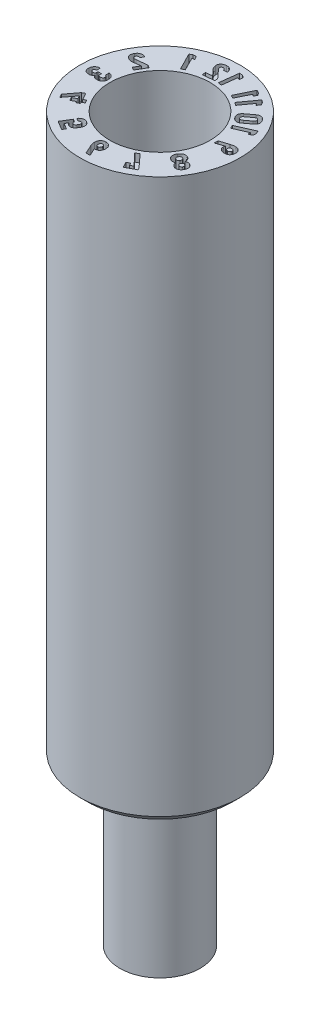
SolidWorks part; units mm, degrees
other "<M2L6-SetScrew>-<Chamfer1>" parameters "D10"=0.19
ref_plane "Front Plane" through (0, 0, 0) normal (0, 0, 1) x (1, 0, 0)
ref_plane "Top Plane" through (0, 0, 0) normal (0, 1, 0) x (1, 0, 0)
ref_plane "Right Plane" through (0, 0, 0) normal (1, 0, 0) x (0, 0, -1)
sketch "Sketch1" plane through (0, 0, 0) normal (0, 0, 1) x (1, 0, 0)
  line L0 (0, 0) -> (0, 20) construction
  line L1 (0, -55) -> (0, 55) construction
  line L2 (1, -14) -> (1.81, -14)
  line L4 (2, -13.81) -> (2, 0)
  line L5 (2, 0) -> (1.25, 0)
  line L6 (1.25, 0) -> (1.25, -2.3)
  line L7 (1.25, -2.3) -> (0.7, -2.3)
  line L8 (0.7, -2.3) -> (0.7, -10.5)
  line L9 (0.7, -10.5) -> (1, -10.5)
  line L10 (1, -10.5) -> (1, -14)
  line L11 (1.81, -14) -> (2, -13.81)
  point P6 (2, -14)
  dimension "D1" = 2.3
  dimension "D2" = 3.5
  dimension "D3" = 1.4
  dimension "D4" = 2.5
  dimension "D5" = 4
  dimension "D6" = 2
  dimension "D7" = 14
revolve "Revolve1" add sketch "Sketch1" angle 360 about L0
sketch "Sketch2" plane through (0, 0, 0) normal (0, 1, 0) x (1, 0, 0)
  line L0 (0, 0) -> (0, 2.1482) construction
  line L1 (0, 0) -> (1.0741, 1.8604) construction
  line L2 (0, 0) -> (1.8604, 1.0741) construction
  line L3 (0, 0) -> (2.1482, 0) construction
  line L4 (0, 0) -> (1.8604, -1.0741) construction
  line L5 (0, 0) -> (1.0741, -1.8604) construction
  line L6 (0, 0) -> (0, -2.1482) construction
  line L7 (0, 0) -> (-1.0741, -1.8604) construction
  line L8 (0, 0) -> (-1.8604, -1.0741) construction
  line L9 (0, 0) -> (-2.1482, 0) construction
  line L10 (0, 0) -> (-1.8604, 1.0741) construction
  line L11 (0, 0) -> (-1.0741, 1.8604) construction
  line L12 (1.2057, 0.5996) -> (1.2425, 0.5167)
  line L13 (1.2425, 0.5167) -> (1.5851, 0.6685)
  line L14 (1.5851, 0.6685) -> (1.5885, 0.606)
  line L15 (1.5885, 0.606) -> (1.6766, 0.645)
  line L16 (1.6766, 0.645) -> (1.6771, 0.7238)
  line L17 (1.6771, 0.7238) -> (1.6457, 0.7946)
  line L18 (1.6457, 0.7946) -> (1.2057, 0.5996)
  line L19 (1.2646, 0.7609) -> (1.4402, 0.8917)
  line L20 (1.268, 1.1229) -> (1.0924, 0.9921)
  line L21 (1.1652, 0.9332) -> (1.3037, 1.0363)
  line L22 (1.3674, 0.9507) -> (1.2289, 0.8476)
  line L23 (0.7385, 1.1261) -> (0.8123, 1.0729)
  line L24 (0.8123, 1.0729) -> (1.0322, 1.3772)
  line L25 (1.0322, 1.3772) -> (1.0667, 1.3249)
  line L26 (1.0667, 1.3249) -> (1.1232, 1.4031)
  line L27 (1.1232, 1.4031) -> (1.084, 1.4716)
  line L28 (1.084, 1.4716) -> (1.021, 1.517)
  line L29 (1.021, 1.517) -> (0.7385, 1.1261)
  line L30 (0.5412, 1.233) -> (0.6225, 1.193)
  line L31 (0.6225, 1.193) -> (0.7879, 1.5289)
  line L32 (0.7879, 1.5289) -> (0.8306, 1.4831)
  line L33 (0.8306, 1.4831) -> (0.8731, 1.5695)
  line L34 (0.8731, 1.5695) -> (0.8231, 1.6303)
  line L35 (0.8231, 1.6303) -> (0.7536, 1.6644)
  line L36 (0.7536, 1.6644) -> (0.5412, 1.233)
  line L37 (0.1081, 1.3422) -> (0.1977, 1.331)
  line L38 (0.1977, 1.331) -> (0.2439, 1.7013)
  line L39 (0.2439, 1.7013) -> (0.2991, 1.6722)
  line L40 (0.2991, 1.6722) -> (0.311, 1.7673)
  line L41 (0.311, 1.7673) -> (0.2439, 1.8082)
  line L42 (0.2439, 1.8082) -> (0.1674, 1.8178)
  line L43 (0.1674, 1.8178) -> (0.1081, 1.3422)
  line L44 (0.0113, 1.4273) -> (-0.1729, 1.6291)
  line L45 (-0.2015, 1.6853) -> (-0.2015, 1.686)
  line L46 (-0.0988, 1.6793) -> (-0.0988, 1.6789)
  line L47 (-0.0988, 1.6789) -> (-0.006, 1.6872)
  line L48 (-0.006, 1.6872) -> (-0.0061, 1.6876)
  line L49 (-0.2949, 1.6803) -> (-0.2949, 1.6799)
  line L50 (-0.2406, 1.5608) -> (-0.1091, 1.4221)
  line L51 (-0.1091, 1.4221) -> (-0.2731, 1.4073)
  line L52 (-0.2731, 1.4073) -> (-0.2652, 1.3202)
  line L53 (-0.2652, 1.3202) -> (0.0186, 1.3457)
  line L54 (0.0186, 1.3457) -> (0.0113, 1.4273)
  line L55 (-0.6617, 1.1726) -> (-0.5814, 1.2135)
  line L56 (-0.5814, 1.2135) -> (-0.7503, 1.5455)
  line L57 (-0.7503, 1.5455) -> (-0.6884, 1.5523)
  line L58 (-0.6884, 1.5523) -> (-0.7319, 1.6377)
  line L59 (-0.7319, 1.6377) -> (-0.8101, 1.634)
  line L60 (-0.8101, 1.634) -> (-0.8787, 1.5991)
  line L61 (-0.8787, 1.5991) -> (-0.6617, 1.1726)
  line L62 (-1.1474, 0.849) -> (-1.4187, 0.8188)
  line L63 (-1.4812, 0.8289) -> (-1.4818, 0.8292)
  line L64 (-1.4158, 0.9083) -> (-1.4155, 0.9081)
  line L65 (-1.4155, 0.9081) -> (-1.3677, 0.9879)
  line L66 (-1.3677, 0.9879) -> (-1.368, 0.9881)
  line L67 (-1.5321, 0.7504) -> (-1.5318, 0.7502)
  line L68 (-1.4034, 0.724) -> (-1.2139, 0.7486)
  line L69 (-1.2139, 0.7486) -> (-1.2986, 0.6075)
  line L70 (-1.2986, 0.6075) -> (-1.2236, 0.5625)
  line L71 (-1.2236, 0.5625) -> (-1.0771, 0.8069)
  line L72 (-1.0771, 0.8069) -> (-1.1474, 0.849)
  line L73 (-1.4629, 0.1949) -> (-1.4655, 0.1015)
  line L74 (-1.4765, -0.0026) -> (-1.4877, -0.0023)
  line L75 (-1.5437, 0.0431) -> (-1.5426, 0.0837)
  line L76 (-1.5426, 0.0837) -> (-1.6297, 0.0861)
  line L77 (-1.6297, 0.0861) -> (-1.6309, 0.0456)
  line L78 (-1.6813, 0.0109) -> (-1.6896, 0.0111)
  line L79 (-1.6803, 0.0997) -> (-1.6777, 0.1928)
  line L80 (-1.7015, -0.0857) -> (-1.687, -0.0861)
  line L81 (-1.4835, -0.0995) -> (-1.469, -0.0999)
  line L82 (-1.3866, -0.5754) -> (-1.6002, -0.8592)
  line L83 (-1.6002, -0.8592) -> (-1.5515, -0.9492)
  line L84 (-1.5515, -0.9492) -> (-1.3395, -0.6708)
  line L85 (-1.3395, -0.6708) -> (-1.2972, -0.7489)
  line L86 (-1.2369, -0.8604) -> (-1.1602, -0.8189)
  line L87 (-1.1602, -0.8189) -> (-1.1781, -0.7858)
  line L88 (-1.3134, -0.5358) -> (-1.3866, -0.5754)
  line L89 (-1.4047, -0.8055) -> (-1.3616, -0.8851)
  line L90 (-1.3616, -0.8851) -> (-1.2548, -0.8273)
  line L91 (-1.1131, -0.7506) -> (-1.1562, -0.671)
  line L92 (-1.1562, -0.671) -> (-1.2212, -0.7062)
  line L93 (-0.8873, -1.1875) -> (-0.8874, -1.1878)
  line L94 (-0.8874, -1.1878) -> (-0.8103, -1.2346)
  line L95 (-0.8103, -1.2346) -> (-0.8102, -1.2343)
  line L96 (-0.7258, -1.2898) -> (-0.7466, -1.3242)
  line L97 (-0.84, -1.2923) -> (-0.9121, -1.2486)
  line L98 (-0.9121, -1.2486) -> (-1.0549, -1.4838)
  line L99 (-1.0549, -1.4838) -> (-0.8351, -1.6172)
  line L100 (-0.8351, -1.6172) -> (-0.79, -1.5429)
  line L101 (-0.79, -1.5429) -> (-0.9326, -1.4564)
  line L102 (-0.9326, -1.4564) -> (-0.8888, -1.384)
  line L103 (-0.6695, -1.371) -> (-0.6487, -1.3366)
  line L104 (-1.2212, -0.7062) -> (-1.3134, -0.5358)
  line L105 (-1.2548, -0.8273) -> (-1.2369, -0.8604)
  line L106 (-1.1781, -0.7858) -> (-1.1131, -0.7506)
  line L107 (-1.2979, -0.7477) -> (-1.4047, -0.8055)
  line L108 (-0.1507, -1.4779) -> (-0.1507, -1.4782)
  line L109 (-0.1188, -1.6117) -> (-0.0234, -1.8193)
  line L110 (-0.0234, -1.8193) -> (0.0789, -1.8203)
  line L111 (0.0789, -1.8203) -> (-0.0139, -1.6229)
  line L113 (0.1303, -1.4827) -> (0.1303, -1.4825)
  line L114 (0.0398, -1.476) -> (0.0398, -1.4763)
  line L115 (-0.0603, -1.4749) -> (-0.0603, -1.4745)
  line L116 (0.9592, -1.4815) -> (0.667, -1.1636)
  line L117 (0.667, -1.1636) -> (0.5809, -1.2098)
  line L118 (0.5809, -1.2098) -> (0.8577, -1.5054)
  line L119 (0.8577, -1.5054) -> (0.7852, -1.5443)
  line L120 (0.7852, -1.5443) -> (0.7511, -1.4808)
  line L121 (0.7511, -1.4808) -> (0.6717, -1.5234)
  line L122 (0.6717, -1.5234) -> (0.7468, -1.6634)
  line L123 (0.7468, -1.6634) -> (0.9875, -1.5341)
  line L124 (0.9875, -1.5341) -> (0.9592, -1.4815)
  line L125 (1.1664, -0.9013) -> (1.173, -0.9055)
  line L126 (1.3562, -1.0104) -> (1.3668, -1.0171)
  line L127 (1.5203, -0.7762) -> (1.5097, -0.7695)
  line L128 (1.3372, -0.6478) -> (1.3306, -0.6436)
  line L129 (1.293, -0.7273) -> (1.2968, -0.7298)
  line L130 (1.23, -0.8341) -> (1.2258, -0.8314)
  line L131 (1.4578, -0.8441) -> (1.4616, -0.8466)
  line L132 (1.4055, -0.9341) -> (1.4014, -0.9314)
  line L134 (1.6864, -0.1011) -> (1.6867, -0.1012)
  line L135 (1.7089, 0.1799) -> (1.7086, 0.1799)
  line L136 (1.5753, 0.1572) -> (1.3623, 0.0888)
  line L137 (1.3623, 0.0888) -> (1.3542, -0.0069)
  line L138 (1.3542, -0.0069) -> (1.5632, 0.0643)
  line L139 (1.7051, 0.0891) -> (1.7054, 0.089)
  line L140 (1.6967, -0.011) -> (1.6963, -0.0109)
  circle A0 centre (0, 0) radius 1.35 construction
  spline S0 degree 3 poles (1.0687, 0.7947) (1.0754, 0.7858) (1.0858, 0.7734) (1.1012, 0.7591) (1.1128, 0.7503) (1.1246, 0.7429) (1.1368, 0.7371) (1.1492, 0.7329) (1.1619, 0.73) (1.1747, 0.7289) (1.1876, 0.729) (1.2004, 0.7307) (1.2133, 0.7339) (1.2263, 0.7384) (1.2438, 0.7468) (1.2565, 0.7547) (1.2646, 0.7609) knots 0 0 0 0 0.147117 0.214402 0.278561 0.339909 0.398973 0.456512 0.51374 0.57063 0.626826 0.684108 0.742238 0.802596 0.865353 1 1 1 1
  spline S1 degree 3 poles (1.4402, 0.8917) (1.4484, 0.8979) (1.4599, 0.9075) (1.4729, 0.9222) (1.4811, 0.9333) (1.4877, 0.9448) (1.4929, 0.9567) (1.4969, 0.9689) (1.4992, 0.9816) (1.5001, 0.9945) (1.4995, 1.0076) (1.4974, 1.0209) (1.4937, 1.0343) (1.4886, 1.0479) (1.4792, 1.0666) (1.4705, 1.0802) (1.4638, 1.089) knots 0 0 0 0 0.136047 0.198883 0.259431 0.317603 0.374632 0.431247 0.487747 0.544883 0.602554 0.661504 0.722654 0.78644 0.853707 1 1 1 1
  spline S2 degree 3 poles (1.4638, 1.089) (1.4572, 1.0979) (1.4468, 1.1104) (1.4313, 1.1246) (1.4198, 1.1335) (1.4081, 1.141) (1.396, 1.1468) (1.3837, 1.1511) (1.3711, 1.154) (1.3583, 1.1553) (1.3455, 1.1551) (1.3326, 1.1536) (1.3197, 1.1502) (1.3068, 1.1456) (1.289, 1.1373) (1.2762, 1.1292) (1.268, 1.1229) knots 0 0 0 0 0.146929 0.214129 0.277956 0.33934 0.397903 0.455386 0.51208 0.56839 0.624514 0.681549 0.739824 0.80036 0.863359 1 1 1 1
  spline S3 degree 3 poles (1.0924, 0.9921) (1.0842, 0.9859) (1.0726, 0.9762) (1.0597, 0.9615) (1.0514, 0.9505) (1.0449, 0.9389) (1.0394, 0.9271) (1.0357, 0.9148) (1.0332, 0.9021) (1.0323, 0.8892) (1.0329, 0.8761) (1.0351, 0.8629) (1.0388, 0.8495) (1.044, 0.8359) (1.0534, 0.8172) (1.0621, 0.8035) (1.0687, 0.7947) knots 0 0 0 0 0.136019 0.198842 0.259378 0.317958 0.375029 0.431628 0.488072 0.545196 0.602448 0.661574 0.722711 0.786484 0.853737 1 1 1 1
  spline S4 degree 3 poles (1.1389, 0.847) (1.1362, 0.8504) (1.1331, 0.8559) (1.1297, 0.8633) (1.1283, 0.8689) (1.1274, 0.8744) (1.1275, 0.8798) (1.1282, 0.8853) (1.1301, 0.8927) (1.1346, 0.9019) (1.1456, 0.9172) (1.1569, 0.9269) (1.1652, 0.9332) knots 0 0 0 0 0.125725 0.183945 0.238714 0.292444 0.345219 0.398346 0.452716 0.568249 0.696065 1 1 1 1
  spline S5 degree 3 poles (1.3037, 1.0363) (1.312, 1.0426) (1.3246, 1.0504) (1.3423, 1.0567) (1.3542, 1.0584) (1.3656, 1.0575) (1.3802, 1.0519) (1.3889, 1.0433) (1.3937, 1.0368) knots 0 0 0 0 0.305311 0.43194 0.547296 0.654391 0.761589 1 1 1 1
  spline S6 degree 3 poles (1.3937, 1.0368) (1.3963, 1.0334) (1.3995, 1.0279) (1.4028, 1.0204) (1.4044, 1.0149) (1.4051, 1.0094) (1.4051, 1.0039) (1.4044, 0.9985) (1.4024, 0.9911) (1.398, 0.9819) (1.3872, 0.9666) (1.3756, 0.957) (1.3674, 0.9507) knots 0 0 0 0 0.125814 0.184074 0.239386 0.292755 0.345568 0.398732 0.45314 0.567811 0.695414 1 1 1 1
  spline S7 degree 3 poles (1.2289, 0.8476) (1.2206, 0.8414) (1.208, 0.8333) (1.1903, 0.8272) (1.1784, 0.8253) (1.167, 0.8263) (1.1524, 0.8319) (1.1437, 0.8405) (1.1389, 0.847) knots 0 0 0 0 0.304488 0.431839 0.547543 0.654592 0.760791 1 1 1 1
  spline S8 degree 3 poles (-0.1729, 1.6291) (-0.1808, 1.6374) (-0.1891, 1.6492) (-0.1962, 1.6644) (-0.1996, 1.6737) (-0.201, 1.6807) (-0.2015, 1.6853) knots 0 0 0 0 0.53955 0.66565 0.783202 1 1 1 1
  spline S9 degree 3 poles (-0.2015, 1.686) (-0.2021, 1.6918) (-0.2016, 1.7006) (-0.197, 1.711) (-0.1919, 1.7174) (-0.1852, 1.7227) (-0.1739, 1.7286) (-0.1639, 1.7302) (-0.1571, 1.7309) knots 0 0 0 0 0.245619 0.358314 0.46938 0.58591 0.710099 1 1 1 1
  spline S10 degree 3 poles (-0.1571, 1.7309) (-0.1501, 1.7317) (-0.1398, 1.7307) (-0.1272, 1.7257) (-0.1191, 1.7197) (-0.1121, 1.712) (-0.104, 1.6989) (-0.1005, 1.6874) (-0.0988, 1.6793) knots 0 0 0 0 0.240793 0.353898 0.468452 0.587551 0.713116 1 1 1 1
  spline S11 degree 3 poles (-0.0061, 1.6876) (-0.0082, 1.7016) (-0.0133, 1.7218) (-0.0242, 1.7467) (-0.0342, 1.7629) (-0.0457, 1.7774) (-0.0588, 1.7897) (-0.0734, 1.8) (-0.0893, 1.8082) (-0.1066, 1.8141) (-0.1316, 1.8193) (-0.1511, 1.8194) (-0.1643, 1.8182) knots 0 0 0 0 0.185577 0.271291 0.354122 0.434342 0.512451 0.589112 0.667053 0.74636 0.827362 1 1 1 1
  spline S12 degree 3 poles (-0.1643, 1.8182) (-0.1782, 1.8168) (-0.1984, 1.8136) (-0.2233, 1.8049) (-0.2396, 1.797) (-0.2541, 1.7876) (-0.2663, 1.7764) (-0.2767, 1.7638) (-0.2848, 1.7496) (-0.2908, 1.734) (-0.2959, 1.7109) (-0.296, 1.6926) (-0.2949, 1.6803) knots 0 0 0 0 0.194757 0.282954 0.366363 0.445797 0.521795 0.596412 0.671721 0.748251 0.827508 1 1 1 1
  spline S13 degree 3 poles (-0.2949, 1.6799) (-0.2939, 1.669) (-0.291, 1.6527) (-0.2842, 1.6316) (-0.2779, 1.6159) (-0.2702, 1.6009) (-0.2585, 1.5819) (-0.2482, 1.5687) (-0.2406, 1.5608) knots 0 0 0 0 0.246099 0.371171 0.498698 0.625929 0.751174 1 1 1 1
  spline S14 degree 3 poles (-1.4187, 0.8188) (-1.4302, 0.8175) (-1.4447, 0.8176) (-1.4612, 0.8209) (-1.4707, 0.8235) (-1.4771, 0.8267) (-1.4812, 0.8289) knots 0 0 0 0 0.541742 0.666101 0.784532 1 1 1 1
  spline S15 degree 3 poles (-1.4818, 0.8292) (-1.4867, 0.8323) (-1.4936, 0.8378) (-1.4992, 0.8477) (-1.5014, 0.8556) (-1.5018, 0.864) (-1.4996, 0.8766) (-1.4954, 0.8857) (-1.4917, 0.8916) knots 0 0 0 0 0.245993 0.357942 0.469858 0.585868 0.709526 1 1 1 1
  spline S16 degree 3 poles (-1.4917, 0.8916) (-1.4882, 0.8976) (-1.4815, 0.9054) (-1.4699, 0.9125) (-1.4603, 0.9156) (-1.45, 0.9169) (-1.4346, 0.9155) (-1.4232, 0.9119) (-1.4158, 0.9083) knots 0 0 0 0 0.2408 0.353192 0.4682 0.587375 0.713815 1 1 1 1
  spline S17 degree 3 poles (-1.368, 0.9881) (-1.3806, 0.9944) (-1.3998, 1.0026) (-1.4264, 1.0081) (-1.4454, 1.0098) (-1.4638, 1.0088) (-1.4815, 1.0056) (-1.4984, 0.9999) (-1.5144, 0.9918) (-1.5292, 0.9813) (-1.5482, 0.9642) (-1.5597, 0.9484) (-1.5665, 0.9371) knots 0 0 0 0 0.185687 0.271471 0.354499 0.434728 0.512246 0.589327 0.667063 0.746194 0.827184 1 1 1 1
  spline S18 degree 3 poles (-1.5665, 0.9371) (-1.5737, 0.9251) (-1.5829, 0.9068) (-1.5906, 0.8816) (-1.5938, 0.8638) (-1.5946, 0.8466) (-1.5928, 0.8301) (-1.5887, 0.8143) (-1.582, 0.7994) (-1.573, 0.7854) (-1.5573, 0.7677) (-1.5427, 0.7568) (-1.5321, 0.7504) knots 0 0 0 0 0.19519 0.283107 0.366166 0.445702 0.522044 0.596667 0.671736 0.748198 0.827887 1 1 1 1
  spline S19 degree 3 poles (-1.5318, 0.7502) (-1.5223, 0.7447) (-1.5075, 0.7373) (-1.4864, 0.7304) (-1.47, 0.7264) (-1.4533, 0.7236) (-1.4311, 0.722) (-1.4144, 0.7225) (-1.4034, 0.724) knots 0 0 0 0 0.246577 0.37111 0.498377 0.626031 0.751387 1 1 1 1
  spline S20 degree 3 poles (-1.3327, 0.0373) (-1.3323, 0.0511) (-1.3335, 0.0716) (-1.3396, 0.0975) (-1.346, 0.1154) (-1.3544, 0.1318) (-1.3646, 0.1467) (-1.377, 0.1597) (-1.391, 0.1712) (-1.4067, 0.1806) (-1.4304, 0.1903) (-1.4497, 0.1939) (-1.4629, 0.1949) knots 0 0 0 0 0.18147 0.26671 0.349597 0.430024 0.508149 0.586299 0.665108 0.744991 0.826258 1 1 1 1
  spline S21 degree 3 poles (-1.4655, 0.1015) (-1.4608, 0.1006) (-1.454, 0.0991) (-1.4458, 0.0953) (-1.4404, 0.0921) (-1.4356, 0.0883) (-1.4313, 0.0842) (-1.4279, 0.0794) (-1.4248, 0.0743) (-1.4227, 0.0687) (-1.4206, 0.0605) (-1.4202, 0.054) (-1.4203, 0.0496) knots 0 0 0 0 0.186659 0.272207 0.355092 0.43542 0.512894 0.589671 0.666759 0.746206 0.827191 1 1 1 1
  spline S22 degree 3 poles (-1.4203, 0.0496) (-1.4204, 0.0419) (-1.4222, 0.0307) (-1.4288, 0.0177) (-1.4355, 0.01) (-1.4437, 0.004) (-1.4572, -0.0019) (-1.4687, -0.0029) (-1.4765, -0.0026) knots 0 0 0 0 0.265732 0.382698 0.497115 0.611866 0.731255 1 1 1 1
  spline S23 degree 3 poles (-1.4877, -0.0023) (-1.4959, -0.0022) (-1.5076, -0.0007) (-1.5216, 0.0045) (-1.5298, 0.0098) (-1.5364, 0.0163) (-1.5426, 0.0272) (-1.544, 0.0367) (-1.5437, 0.0431) knots 0 0 0 0 0.300152 0.427434 0.546001 0.656233 0.765208 1 1 1 1
  spline S24 degree 3 poles (-1.6309, 0.0456) (-1.631, 0.0403) (-1.6326, 0.0325) (-1.6387, 0.024) (-1.6446, 0.0189) (-1.6521, 0.0151) (-1.6642, 0.0111) (-1.6743, 0.0108) (-1.6813, 0.0109) knots 0 0 0 0 0.227856 0.334861 0.447165 0.566801 0.696079 1 1 1 1
  spline S25 degree 3 poles (-1.6896, 0.0111) (-1.6962, 0.0113) (-1.7057, 0.0125) (-1.717, 0.0173) (-1.7236, 0.0221) (-1.7288, 0.0281) (-1.734, 0.0378) (-1.7347, 0.0463) (-1.7348, 0.052) knots 0 0 0 0 0.287075 0.411291 0.528016 0.640251 0.752763 1 1 1 1
  spline S26 degree 3 poles (-1.7348, 0.052) (-1.7345, 0.0559) (-1.7338, 0.0618) (-1.7308, 0.069) (-1.728, 0.0742) (-1.7244, 0.0791) (-1.7199, 0.0833) (-1.715, 0.0873) (-1.7092, 0.0908) (-1.7029, 0.0939) (-1.6933, 0.0972) (-1.6856, 0.099) (-1.6803, 0.0997) knots 0 0 0 0 0.149554 0.222696 0.296825 0.372637 0.449681 0.529388 0.613794 0.702933 0.796649 1 1 1 1
  spline S27 degree 3 poles (-1.6777, 0.1928) (-1.6916, 0.192) (-1.7119, 0.1888) (-1.7372, 0.1802) (-1.7542, 0.1718) (-1.7695, 0.1617) (-1.783, 0.1498) (-1.7948, 0.1364) (-1.8045, 0.1215) (-1.8123, 0.1053) (-1.8199, 0.082) (-1.8224, 0.0635) (-1.8227, 0.051) knots 0 0 0 0 0.185509 0.271899 0.355812 0.437203 0.516524 0.594887 0.673786 0.753317 0.833473 1 1 1 1
  spline S28 degree 3 poles (-1.8227, 0.051) (-1.8228, 0.041) (-1.8226, 0.0263) (-1.8195, 0.0074) (-1.8164, -0.0055) (-1.8121, -0.0176) (-1.8069, -0.0288) (-1.8004, -0.039) (-1.7931, -0.0484) (-1.7847, -0.0568) (-1.7755, -0.0643) (-1.7652, -0.0705) (-1.7542, -0.0757) (-1.7423, -0.08) (-1.7247, -0.0841) (-1.7109, -0.0855) (-1.7015, -0.0857) knots 0 0 0 0 0.144716 0.211633 0.275638 0.336813 0.395776 0.453872 0.51089 0.567868 0.624541 0.681814 0.740275 0.800584 0.863719 1 1 1 1
  spline S29 degree 3 poles (-1.687, -0.0861) (-1.6765, -0.0863) (-1.6609, -0.085) (-1.6415, -0.0782) (-1.6283, -0.0712) (-1.6163, -0.0622) (-1.6021, -0.0474) (-1.5942, -0.0337) (-1.5901, -0.024) knots 0 0 0 0 0.257097 0.378505 0.499642 0.620567 0.742525 1 1 1 1
  spline S30 degree 3 poles (-1.5901, -0.024) (-1.5889, -0.0296) (-1.5868, -0.0379) (-1.5821, -0.0481) (-1.5781, -0.0552) (-1.5734, -0.0618) (-1.5681, -0.0679) (-1.562, -0.0736) (-1.5554, -0.0788) (-1.5481, -0.0834) (-1.5404, -0.0875) (-1.5321, -0.091) (-1.5233, -0.0938) (-1.5141, -0.0962) (-1.5008, -0.0985) (-1.4905, -0.0993) (-1.4835, -0.0995) knots 0 0 0 0 0.120945 0.179043 0.236236 0.292478 0.349832 0.407382 0.466671 0.526684 0.588797 0.651625 0.715641 0.782899 0.852119 1 1 1 1
  spline S31 degree 3 poles (-1.469, -0.0999) (-1.456, -0.1003) (-1.4368, -0.0992) (-1.4128, -0.0926) (-1.3968, -0.0859) (-1.3825, -0.077) (-1.3698, -0.0661) (-1.3589, -0.0533) (-1.3499, -0.0384) (-1.3425, -0.0219) (-1.3353, 0.0033) (-1.3331, 0.0235) (-1.3327, 0.0373) knots 0 0 0 0 0.178436 0.259593 0.337967 0.413977 0.489162 0.56469 0.643105 0.724889 0.810768 1 1 1 1
  spline S32 degree 3 poles (-0.6931, -1.1379) (-0.7036, -1.1314) (-0.7202, -1.1237) (-0.7436, -1.1179) (-0.7611, -1.1161) (-0.7785, -1.1164) (-0.7958, -1.1194) (-0.8127, -1.1249) (-0.8292, -1.1327) (-0.8452, -1.143) (-0.866, -1.1601) (-0.8792, -1.1761) (-0.8873, -1.1875) knots 0 0 0 0 0.165175 0.244356 0.32274 0.400733 0.478471 0.557132 0.639126 0.723582 0.811412 1 1 1 1
  spline S33 degree 3 poles (-0.8102, -1.2343) (-0.8054, -1.2279) (-0.7975, -1.2192) (-0.7849, -1.2112) (-0.7754, -1.2074) (-0.7658, -1.2055) (-0.7526, -1.2061) (-0.7431, -1.2098) (-0.7374, -1.2134) knots 0 0 0 0 0.286525 0.412587 0.531803 0.647341 0.759878 1 1 1 1
  spline S34 degree 3 poles (-0.7374, -1.2134) (-0.7313, -1.217) (-0.7232, -1.224) (-0.7164, -1.236) (-0.7138, -1.2458) (-0.7133, -1.2562) (-0.716, -1.2715) (-0.7215, -1.2825) (-0.7258, -1.2898) knots 0 0 0 0 0.244815 0.356536 0.469551 0.586465 0.710867 1 1 1 1
  spline S35 degree 3 poles (-0.7466, -1.3242) (-0.751, -1.3313) (-0.7581, -1.3411) (-0.77, -1.3509) (-0.7789, -1.3557) (-0.788, -1.3581) (-0.8006, -1.3584) (-0.8097, -1.3548) (-0.8151, -1.3515) knots 0 0 0 0 0.302668 0.432049 0.550615 0.662532 0.770151 1 1 1 1
  spline S36 degree 3 poles (-0.8151, -1.3515) (-0.8204, -1.3485) (-0.8273, -1.3426) (-0.8347, -1.3335) (-0.8385, -1.3259) (-0.841, -1.3179) (-0.8427, -1.3066) (-0.8414, -1.298) (-0.84, -1.2923) knots 0 0 0 0 0.264014 0.38617 0.50763 0.628142 0.747849 1 1 1 1
  spline S37 degree 3 poles (-0.8888, -1.384) (-0.8876, -1.3889) (-0.8844, -1.396) (-0.8787, -1.4051) (-0.8732, -1.412) (-0.8671, -1.4186) (-0.8584, -1.4267) (-0.8511, -1.4318) (-0.8461, -1.4349) knots 0 0 0 0 0.220429 0.34331 0.473858 0.608439 0.740151 1 1 1 1
  spline S38 degree 3 poles (-0.8461, -1.4349) (-0.8362, -1.4409) (-0.8206, -1.4483) (-0.7988, -1.4529) (-0.7829, -1.4538) (-0.7672, -1.4521) (-0.7517, -1.4478) (-0.7367, -1.4409) (-0.7219, -1.4317) (-0.7078, -1.4199) (-0.689, -1.4004) (-0.677, -1.3832) (-0.6695, -1.371) knots 0 0 0 0 0.163894 0.239325 0.313485 0.386959 0.461675 0.538527 0.619658 0.70564 0.797188 1 1 1 1
  spline S39 degree 3 poles (-0.6487, -1.3366) (-0.6412, -1.3242) (-0.6317, -1.3053) (-0.6241, -1.2791) (-0.6213, -1.2605) (-0.6212, -1.2423) (-0.6235, -1.2248) (-0.6287, -1.208) (-0.6365, -1.1919) (-0.6469, -1.1768) (-0.6646, -1.1571) (-0.6813, -1.1452) (-0.6931, -1.1379) knots 0 0 0 0 0.187226 0.272173 0.353031 0.430958 0.506787 0.581594 0.658156 0.736932 0.81949 1 1 1 1
  spline S40 degree 3 poles (-0.0089, -1.3344) (-0.0226, -1.3344) (-0.0429, -1.3357) (-0.0681, -1.3429) (-0.0848, -1.3502) (-0.0999, -1.3595) (-0.1131, -1.371) (-0.1245, -1.3844) (-0.1339, -1.3997) (-0.1413, -1.4169) (-0.1487, -1.4429) (-0.1504, -1.4637) (-0.1507, -1.4779) knots 0 0 0 0 0.18008 0.262559 0.341805 0.418388 0.493938 0.569717 0.647582 0.728493 0.813373 1 1 1 1
  spline S41 degree 3 poles (-0.1507, -1.4782) (-0.1508, -1.4872) (-0.1502, -1.5009) (-0.1475, -1.5192) (-0.1422, -1.5488) (-0.1345, -1.5731) (-0.1271, -1.5921) knots 0 0 0 0 0.229748 0.350755 0.47607 1 1 1 1
  spline S42 degree 3 poles (-0.1271, -1.5921) (-0.1259, -1.5955) (-0.1232, -1.602) (-0.1204, -1.6086) (-0.1188, -1.6117) knots 0 0 0 0 0.506767 1 1 1 1
  spline S43 degree 3 poles (-0.0139, -1.6229) (-0.0082, -1.6241) (-0.0023, -1.6248) (0.0036, -1.6248) knots 0.757686 0.757686 0.757686 0.757686 1 1 1 1
  spline S44 degree 3 poles (0.0036, -1.6248) (0.016, -1.6249) (0.0341, -1.6232) (0.0567, -1.6164) (0.0716, -1.6091) (0.085, -1.5998) (0.0968, -1.5885) (0.1068, -1.5751) (0.1152, -1.56) (0.1218, -1.543) (0.1283, -1.5173) (0.1302, -1.4968) (0.1303, -1.4827) knots 0 0 0 0 0.171345 0.250396 0.326546 0.401458 0.476069 0.552514 0.632136 0.715827 0.804355 1 1 1 1
  spline S45 degree 3 poles (0.1303, -1.4825) (0.1304, -1.468) (0.1288, -1.447) (0.1221, -1.4206) (0.1151, -1.4031) (0.106, -1.3874) (0.0949, -1.3735) (0.082, -1.3616) (0.0671, -1.3519) (0.0504, -1.3442) (0.0252, -1.3365) (0.0049, -1.3347) (-0.0089, -1.3344) knots 0 0 0 0 0.187142 0.271906 0.353319 0.431398 0.507206 0.582506 0.658871 0.737736 0.819762 1 1 1 1
  spline S46 degree 3 poles (-0.0099, -1.4216) (-0.0027, -1.4217) (0.008, -1.4231) (0.0202, -1.4294) (0.0275, -1.4357) (0.0332, -1.4437) (0.0388, -1.457) (0.0398, -1.4683) (0.0398, -1.476) knots 0 0 0 0 0.258656 0.375095 0.48781 0.602931 0.723137 1 1 1 1
  spline S47 degree 3 poles (0.0398, -1.4763) (0.0398, -1.4851) (0.0383, -1.4978) (0.0326, -1.513) (0.0267, -1.522) (0.0193, -1.5291) (0.007, -1.5359) (-0.0037, -1.5376) (-0.011, -1.5375) knots 0 0 0 0 0.294535 0.419417 0.53643 0.648384 0.757736 1 1 1 1
  spline S48 degree 3 poles (-0.011, -1.5375) (-0.0182, -1.5375) (-0.0288, -1.5356) (-0.0408, -1.5283) (-0.048, -1.5209) (-0.0536, -1.5117) (-0.0594, -1.4964) (-0.0604, -1.4837) (-0.0603, -1.4749) knots 0 0 0 0 0.23995 0.349402 0.462219 0.580838 0.707003 1 1 1 1
  spline S49 degree 3 poles (-0.0603, -1.4745) (-0.0601, -1.4669) (-0.059, -1.4556) (-0.0529, -1.4427) (-0.0471, -1.4349) (-0.0397, -1.4287) (-0.0275, -1.4227) (-0.017, -1.4214) (-0.0099, -1.4216) knots 0 0 0 0 0.277746 0.397907 0.513312 0.626858 0.742197 1 1 1 1
  spline S50 degree 3 poles (1.1356, -0.7004) (1.1278, -0.7125) (1.118, -0.7314) (1.1097, -0.7577) (1.106, -0.7768) (1.105, -0.7955) (1.1062, -0.8137) (1.1104, -0.831) (1.1168, -0.8476) (1.1257, -0.8632) (1.1409, -0.8827) (1.1558, -0.8944) (1.1664, -0.9013) knots 0 0 0 0 0.189024 0.276465 0.361346 0.443172 0.522222 0.599217 0.676568 0.754549 0.833586 1 1 1 1
  spline S51 degree 3 poles (1.173, -0.9055) (1.1829, -0.912) (1.1994, -0.9192) (1.2228, -0.9243) (1.2411, -0.9255) (1.2594, -0.9246) (1.2831, -0.9198) (1.2998, -0.9126) (1.3101, -0.9063) knots 0 0 0 0 0.246248 0.36981 0.497586 0.62553 0.74997 1 1 1 1
  spline S52 degree 3 poles (1.3101, -0.9063) (1.3089, -0.9165) (1.3091, -0.932) (1.3135, -0.952) (1.3188, -0.9664) (1.3258, -0.9797) (1.337, -0.9957) (1.3481, -1.0052) (1.3562, -1.0104) knots 0 0 0 0 0.257634 0.383969 0.512178 0.63875 0.760226 1 1 1 1
  spline S53 degree 3 poles (1.3668, -1.0171) (1.3768, -1.0235) (1.3928, -1.0314) (1.4154, -1.0367) (1.4322, -1.0382) (1.449, -1.0374) (1.4654, -1.0338) (1.4815, -1.028) (1.4971, -1.0197) (1.5119, -1.0092) (1.531, -0.9917) (1.5431, -0.976) (1.5503, -0.9646) knots 0 0 0 0 0.166843 0.24576 0.323892 0.401834 0.47907 0.557953 0.639972 0.724759 0.811863 1 1 1 1
  spline S54 degree 3 poles (1.5503, -0.9646) (1.5576, -0.9533) (1.5665, -0.9356) (1.5745, -0.911) (1.5777, -0.893) (1.5786, -0.8755) (1.5771, -0.8585) (1.5732, -0.8422) (1.5671, -0.8266) (1.5587, -0.8119) (1.5441, -0.7938) (1.5303, -0.7826) (1.5203, -0.7762) knots 0 0 0 0 0.18822 0.275887 0.360568 0.442199 0.520571 0.598287 0.676068 0.754136 0.833334 1 1 1 1
  spline S55 degree 3 poles (1.5097, -0.7695) (1.5014, -0.7643) (1.4879, -0.7581) (1.4685, -0.7546) (1.4534, -0.754) (1.4382, -0.7556) (1.4181, -0.7602) (1.4041, -0.7669) (1.3953, -0.7724) knots 0 0 0 0 0.242631 0.363632 0.489586 0.61716 0.743052 1 1 1 1
  spline S56 degree 3 poles (1.3953, -0.7724) (1.3968, -0.7603) (1.3961, -0.742) (1.3906, -0.7182) (1.3839, -0.7011) (1.3752, -0.6851) (1.3609, -0.6658) (1.3471, -0.6543) (1.3372, -0.6478) knots 0 0 0 0 0.252067 0.377226 0.504951 0.631507 0.754483 1 1 1 1
  spline S57 degree 3 poles (1.3306, -0.6436) (1.3199, -0.6369) (1.3029, -0.6285) (1.2789, -0.6228) (1.261, -0.6212) (1.2433, -0.6223) (1.2258, -0.6261) (1.2088, -0.6324) (1.1923, -0.6413) (1.1765, -0.6527) (1.1562, -0.6714) (1.1434, -0.6883) (1.1356, -0.7004) knots 0 0 0 0 0.166718 0.245383 0.323164 0.400804 0.477699 0.556461 0.638208 0.723109 0.811263 1 1 1 1
  spline S58 degree 3 poles (1.2094, -0.7475) (1.2123, -0.7425) (1.2178, -0.7359) (1.2262, -0.7285) (1.2329, -0.7241) (1.2399, -0.7206) (1.2472, -0.7183) (1.2548, -0.717) (1.2625, -0.7169) (1.2703, -0.7178) (1.2808, -0.7208) (1.2883, -0.7242) (1.293, -0.7273) knots 0 0 0 0 0.179488 0.264077 0.346581 0.427459 0.505239 0.584541 0.664119 0.745149 0.82675 1 1 1 1
  spline S59 degree 3 poles (1.2968, -0.7298) (1.301, -0.7327) (1.3071, -0.7373) (1.3133, -0.7452) (1.3169, -0.7515) (1.3195, -0.7582) (1.321, -0.7653) (1.3217, -0.7726) (1.3213, -0.7802) (1.3199, -0.7879) (1.3165, -0.7986) (1.3126, -0.8063) (1.3094, -0.8112) knots 0 0 0 0 0.166626 0.245296 0.323526 0.40094 0.47826 0.556475 0.637786 0.722235 0.810327 1 1 1 1
  spline S60 degree 3 poles (1.3094, -0.8112) (1.3063, -0.8161) (1.3009, -0.8228) (1.2928, -0.8305) (1.2864, -0.835) (1.2797, -0.8386) (1.2728, -0.8411) (1.2656, -0.8426) (1.2584, -0.843) (1.2511, -0.8424) (1.2412, -0.8403) (1.2345, -0.8366) (1.23, -0.8341) knots 0 0 0 0 0.188874 0.27561 0.359843 0.441041 0.52067 0.598148 0.676077 0.755083 0.833778 1 1 1 1
  spline S61 degree 3 poles (1.2258, -0.8314) (1.2213, -0.8283) (1.2146, -0.8233) (1.2079, -0.8149) (1.2038, -0.8083) (1.2007, -0.8013) (1.1987, -0.794) (1.1978, -0.7864) (1.198, -0.7786) (1.1992, -0.7708) (1.2025, -0.7601) (1.2063, -0.7524) (1.2094, -0.7475) knots 0 0 0 0 0.173374 0.254627 0.335349 0.414842 0.492689 0.571561 0.652149 0.734616 0.81959 1 1 1 1
  spline S62 degree 3 poles (1.3837, -0.8585) (1.3864, -0.8544) (1.3909, -0.8486) (1.3983, -0.8426) (1.4041, -0.839) (1.4103, -0.8364) (1.4167, -0.8345) (1.4233, -0.8338) (1.4302, -0.834) (1.4372, -0.8351) (1.4467, -0.8378) (1.4534, -0.8414) (1.4578, -0.8441) knots 0 0 0 0 0.173386 0.256041 0.335766 0.414175 0.491607 0.56989 0.650737 0.734101 0.818814 1 1 1 1
  spline S63 degree 3 poles (1.4616, -0.8466) (1.4657, -0.8492) (1.4713, -0.8535) (1.4773, -0.8607) (1.4809, -0.8662) (1.4835, -0.8722) (1.4853, -0.8783) (1.4861, -0.8847) (1.4861, -0.8913) (1.485, -0.8979) (1.4824, -0.907) (1.4791, -0.9136) (1.4765, -0.9177) knots 0 0 0 0 0.176178 0.258479 0.338963 0.417899 0.495696 0.573906 0.652986 0.735208 0.819758 1 1 1 1
  spline S64 degree 3 poles (1.4765, -0.9177) (1.4738, -0.9218) (1.4694, -0.9275) (1.4622, -0.9337) (1.4566, -0.9374) (1.4507, -0.9403) (1.4445, -0.9422) (1.4381, -0.9431) (1.4316, -0.9432) (1.4249, -0.9424) (1.4159, -0.94) (1.4095, -0.9367) (1.4055, -0.9341) knots 0 0 0 0 0.179946 0.2623 0.343875 0.423708 0.502251 0.579866 0.659263 0.740881 0.823596 1 1 1 1
  spline S65 degree 3 poles (1.4014, -0.9314) (1.3972, -0.9287) (1.3912, -0.9242) (1.3848, -0.9167) (1.3809, -0.9109) (1.378, -0.9048) (1.3758, -0.8985) (1.3748, -0.8919) (1.3746, -0.8852) (1.3754, -0.8784) (1.3778, -0.8692) (1.3811, -0.8627) (1.3837, -0.8585) knots 0 0 0 0 0.179176 0.264083 0.347045 0.427038 0.505565 0.583291 0.662635 0.743014 0.824364 1 1 1 1
  spline S66 degree 3 poles (1.5632, 0.0643) (1.563, 0.0638) (1.5617, 0.0604) (1.5582, 0.05) (1.5566, 0.0396) (1.556, 0.0325) knots 0.562076 0.562076 0.562076 0.562076 0.581289 0.712569 1 1 1 1
  spline S67 degree 3 poles (1.556, 0.0325) (1.555, 0.021) (1.5556, 0.0039) (1.5613, -0.018) (1.5678, -0.033) (1.5764, -0.0469) (1.587, -0.0594) (1.5995, -0.0706) (1.6139, -0.0801) (1.6299, -0.0882) (1.654, -0.0967) (1.6732, -0.1001) (1.6864, -0.1011) knots 0 0 0 0 0.164807 0.243017 0.320825 0.398415 0.475798 0.554532 0.636715 0.722056 0.810541 1 1 1 1
  spline S68 degree 3 poles (1.6867, -0.1012) (1.7012, -0.1023) (1.7225, -0.1025) (1.7495, -0.0977) (1.7676, -0.0919) (1.7841, -0.0841) (1.7986, -0.074) (1.8115, -0.0619) (1.8223, -0.0477) (1.8313, -0.0317) (1.8408, -0.007) (1.8443, 0.0131) (1.8455, 0.0269) knots 0 0 0 0 0.187932 0.273184 0.354485 0.432536 0.507991 0.582977 0.659387 0.738226 0.820028 1 1 1 1
  spline S69 degree 3 poles (1.8455, 0.0269) (1.8468, 0.0407) (1.8464, 0.061) (1.8412, 0.0869) (1.8349, 0.1042) (1.8264, 0.12) (1.8156, 0.1341) (1.8027, 0.1465) (1.7877, 0.1571) (1.7706, 0.1659) (1.7445, 0.1751) (1.7234, 0.1787) (1.7089, 0.1799) knots 0 0 0 0 0.178152 0.259775 0.338559 0.414814 0.489965 0.566117 0.644415 0.725935 0.81166 1 1 1 1
  spline S70 degree 3 poles (1.7086, 0.1799) (1.7002, 0.1806) (1.6872, 0.1807) (1.6696, 0.1794) (1.6556, 0.1775) (1.6411, 0.1749) (1.6204, 0.1703) (1.6046, 0.1661) (1.594, 0.163) knots 0 0 0 0 0.216798 0.332717 0.454129 0.580864 0.713913 1 1 1 1
  spline S71 degree 3 poles (1.594, 0.163) (1.5908, 0.1621) (1.5845, 0.1605) (1.5784, 0.1583) (1.5753, 0.1572) knots 0 0 0 0 0.5044 1 1 1 1
  spline S72 degree 3 poles (1.6422, 0.0442) (1.6428, 0.0513) (1.6452, 0.0619) (1.6531, 0.0733) (1.6604, 0.0802) (1.6696, 0.0851) (1.6845, 0.0896) (1.6968, 0.0897) (1.7051, 0.0891) knots 0 0 0 0 0.246575 0.358348 0.471223 0.587917 0.711607 1 1 1 1
  spline S73 degree 3 poles (1.7054, 0.089) (1.7135, 0.0883) (1.7252, 0.0863) (1.7385, 0.0792) (1.7463, 0.0728) (1.7523, 0.0649) (1.7578, 0.0523) (1.7582, 0.0415) (1.7577, 0.0344) knots 0 0 0 0 0.283708 0.406216 0.522108 0.634951 0.749354 1 1 1 1
  spline S74 degree 3 poles (1.7577, 0.0344) (1.7569, 0.0273) (1.7548, 0.0166) (1.7471, 0.005) (1.7398, -0.0018) (1.731, -0.0069) (1.7166, -0.0114) (1.7048, -0.0118) (1.6967, -0.011) knots 0 0 0 0 0.252361 0.366488 0.478891 0.595532 0.718178 1 1 1 1
  spline S75 degree 3 poles (1.6963, -0.0109) (1.688, -0.0101) (1.6759, -0.0081) (1.6621, -0.001) (1.654, 0.0055) (1.6479, 0.0134) (1.6421, 0.0261) (1.6417, 0.037) (1.6422, 0.0442) knots 0 0 0 0 0.287702 0.410795 0.52714 0.639226 0.750896 1 1 1 1
  point P17 (0, 0)
  dimension "D1" = 2.7
  dimension "D2" = 12
extrude "Cut-Extrude1" cut sketch "Sketch2" against normal blind 0.2
inserted part "M2L6-SetScrew"
move or copy body "Body-Move/Copy2" placed by mates yes
other "Distance1" parameters "D1"=4
